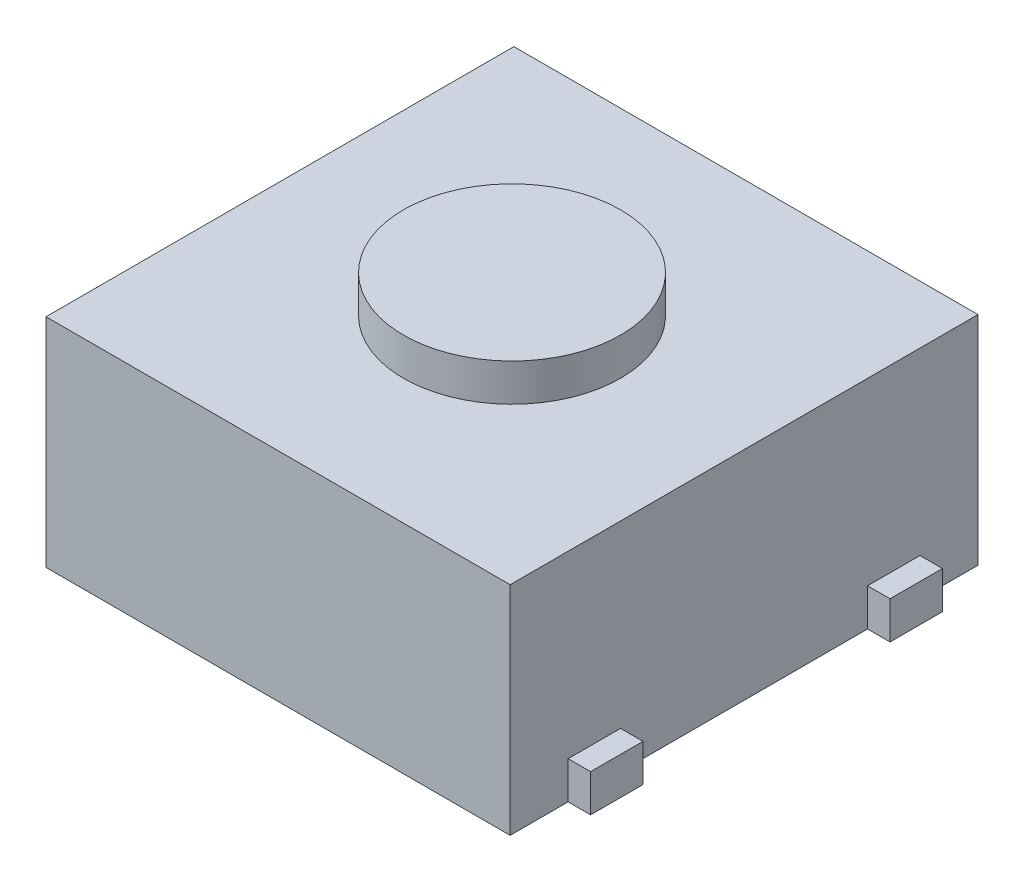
SolidWorks part; units mm, degrees
ref_plane "Front" through (0, 0, 0) normal (0, 0, 1) x (1, 0, 0)
ref_plane "Top" through (0, 0, 0) normal (0, 1, 0) x (1, 0, 0)
ref_plane "Right" through (0, 0, 0) normal (1, 0, 0) x (0, 0, -1)
sketch "Sketch1" plane through (0, 0, 0) normal (0, 1, 0) x (1, 0, 0)
  line L1 (0, 0) -> (6.2, 0)
  line L2 (0, 0) -> (0, 6.25)
  line L3 (0, 6.25) -> (6.2, 6.25)
  line L4 (6.2, 0) -> (6.2, 6.25)
  dimension "D1" = 6.2
  dimension "D2" = 6.25
extrude "Boss-Extrude1" add sketch "Sketch1" along normal blind 2.9
sketch "Sketch2" plane through (0, 0, 0) normal (0, -1, 0) x (1, 0, 0)
  line L0 (0, -6.25) -> (0, 0) construction
  line L1 (0, -5.475) -> (-0.3, -5.475)
  line L2 (0, -5.475) -> (0, -4.775)
  line L3 (0, -4.775) -> (-0.3, -4.775)
  line L4 (-0.3, -5.475) -> (-0.3, -4.775)
  line L5 (6.2, 0) -> (6.2, -6.25) construction
  line L6 (0, -1.475) -> (-0.3, -1.475)
  line L7 (0, -1.475) -> (0, -0.775)
  line L8 (0, -0.775) -> (-0.3, -0.775)
  line L9 (-0.3, -1.475) -> (-0.3, -0.775)
  line L10 (6.2, -0.775) -> (6.5, -0.775)
  line L11 (6.2, -0.775) -> (6.2, -1.475)
  line L12 (6.2, -1.475) -> (6.5, -1.475)
  line L13 (6.5, -0.775) -> (6.5, -1.475)
  line L14 (6.2, -3.125) -> (0, -3.125) construction
  line L15 (6.2, -4.775) -> (6.5, -4.775)
  line L16 (6.2, -4.775) -> (6.2, -5.475)
  line L17 (6.2, -5.475) -> (6.5, -5.475)
  line L18 (6.5, -4.775) -> (6.5, -5.475)
  line L19 (3.1, 0) -> (3.1, -6.25) construction
  line L20 (0, 0) -> (6.2, 0) construction
  line L21 (6.2, -6.25) -> (0, -6.25) construction
  line L24 (0, -5.475) -> (0, -4.775)
  line L28 (0, -1.475) -> (0, -0.775)
  line L32 (6.2, -1.475) -> (6.2, -0.775)
  line L36 (6.2, -4.775) -> (6.2, -5.475)
  point P28 (-0.3, -5.125)
  point P29 (-0.3, -1.125)
  dimension "D1" = 6.8
  dimension "D2" = 0.7
  dimension "D3" = 4
extrude "Boss-Extrude2" add sketch "Sketch2" against normal blind 0.5
sketch "Sketch3" plane through (0, 2.9, 0) normal (0, 1, 0) x (1, 0, 0)
  line L0 (3.1, 0) -> (3.1, 6.25) construction
  line L1 (0, 0) -> (6.2, 0) construction
  line L2 (6.2, 6.25) -> (0, 6.25) construction
  line L3 (0, 3.125) -> (6.2, 3.125) construction
  line L4 (0, 6.25) -> (0, 0) construction
  line L5 (6.2, 0) -> (6.2, 6.25) construction
  circle A0 centre (3.1, 3.125) radius 1.45
  dimension "D1" = 2.9
extrude "Boss-Extrude4" add sketch "Sketch3" along normal offset from surface (0.5 mm away) 3.4
